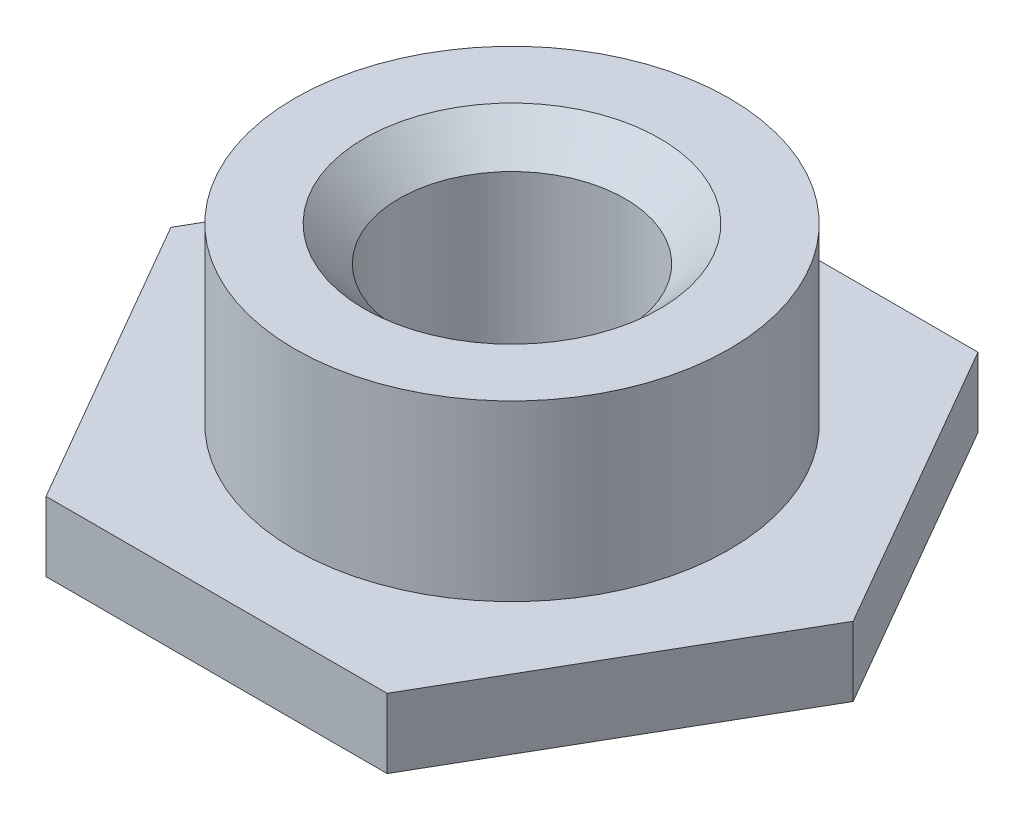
SolidWorks part; units mm, degrees
ref_plane "Спереди" through (0, 0, 0) normal (0, 0, 1) x (1, 0, 0)
ref_plane "Сверху" through (0, 0, 0) normal (0, 1, 0) x (1, 0, 0)
ref_plane "Справа" through (0, 0, 0) normal (1, 0, 0) x (0, 0, -1)
sketch "Эскиз1" plane through (0, 0, 0) normal (0, 1, 0) x (1, 0, 0)
  line L1 (9.815, 0) -> (4.9075, 8.5)
  line L2 (4.9075, 8.5) -> (-4.9075, 8.5)
  line L3 (-4.9075, 8.5) -> (-9.815, 0)
  line L4 (-9.815, 0) -> (-4.9075, -8.5)
  line L5 (-4.9075, -8.5) -> (4.9075, -8.5)
  line L6 (4.9075, -8.5) -> (9.815, 0)
  circle A0 centre (0, 0) radius 8.5 construction
  dimension "D1" = 17
extrude "Бобышка-Вытянуть1" add sketch "Эскиз1" along normal blind 2
sketch "Эскиз2" plane through (0, 2, 0) normal (0, 1, 0) x (1, 0, 0)
  circle A0 centre (0, 0) radius 6.25
  dimension "D1" = 12.5
extrude "Бобышка-Вытянуть2" add sketch "Эскиз2" along normal blind 5
sketch "Эскиз3" plane through (0, 7, 0) normal (0, 1, 0) x (1, 0, 0)
  circle A0 centre (0, 0) radius 3.25
  dimension "D1" = 6.5
extrude "Вырез-Вытянуть1" cut sketch "Эскиз3" against normal through all
chamfer "Фаска1" distance 1 angle 45 1 edges at (0, 7, 3.25)
chamfer "Фаска2" distance 0.5 angle 45 1 edges at (0, 0, 3.25)
